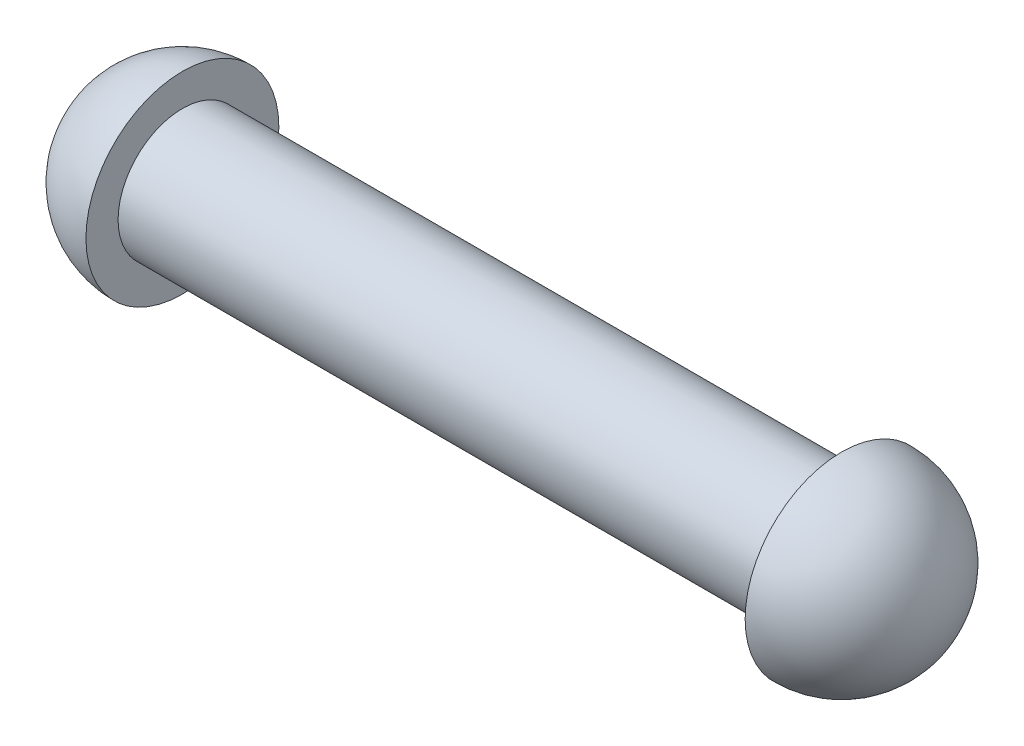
SolidWorks part; units mm, degrees
ref_plane "Face" through (0, 0, 0) normal (0, 0, 1) x (1, 0, 0)
ref_plane "Dessus" through (0, 0, 0) normal (0, 1, 0) x (1, 0, 0)
ref_plane "Droite" through (0, 0, 0) normal (1, 0, 0) x (0, 0, -1)
sketch "Esquisse1" plane through (0, 0, 0) normal (0, 0, 1) x (1, 0, 0)
  line L0 (-6, 0) -> (103.2452, 0) construction
  line L1 (0, 6) -> (0, 4)
  line L2 (0, 4) -> (41, 4)
  line L3 (41, 4) -> (41, 6)
  line L4 (-6, 0) -> (47, 0)
  arc A0 (0, 6) -> (-6, 0) centre (0, 0) ccw
  arc A1 (47, 0) -> (41, 6) centre (41, 0) ccw
  dimension "D1" = 12
  dimension "D2" = 12
  dimension "D3" = 41
  dimension "D4" = 8
revolve "Révolution1" add sketch "Esquisse1" angle 360 about L0
